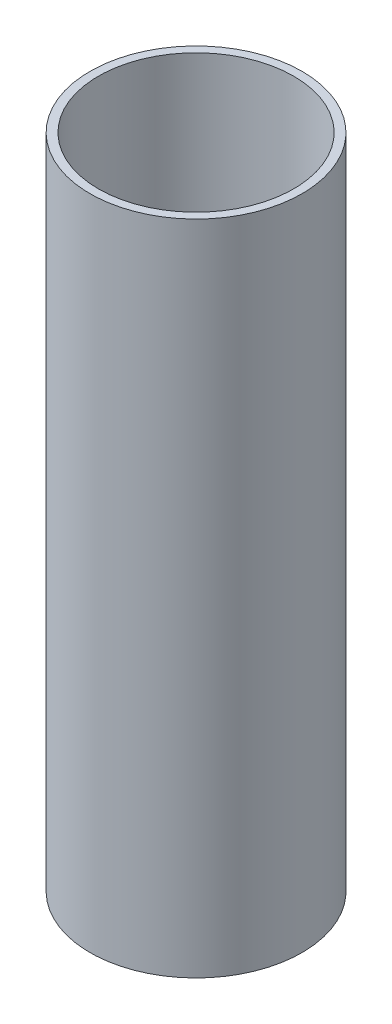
SolidWorks part; units mm, degrees
ref_plane "Front Plane" through (0, 0, 0) normal (0, 0, 1) x (1, 0, 0)
ref_plane "Top Plane" through (0, 0, 0) normal (0, 1, 0) x (1, 0, 0)
ref_plane "Right Plane" through (0, 0, 0) normal (1, 0, 0) x (0, 0, -1)
sketch "Sketch1" plane through (0, 0, 0) normal (0, 1, 0) x (1, 0, 0)
  circle A0 centre (0, 0) radius 34.8615
  circle A1 centre (0, 0) radius 37.846
  dimension "D1" = 75.692
  dimension "D2" = 2.9845
extrude "Boss-Extrude1" add sketch "Sketch1" along normal blind 234.6086
